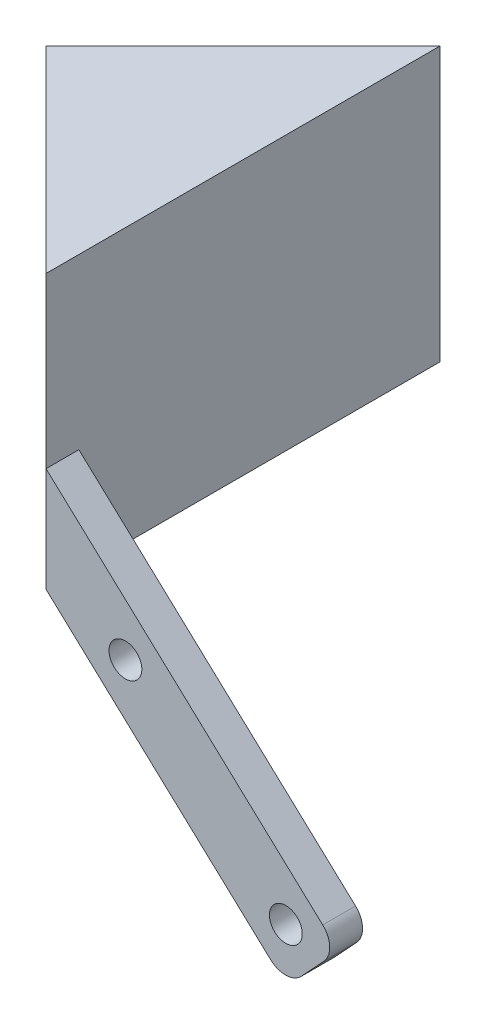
SolidWorks part; units mm, degrees
ref_plane "Plan de face" through (0, 0, 0) normal (0, 0, 1) x (1, 0, 0)
ref_plane "Plan de dessus" through (0, 0, 0) normal (0, 1, 0) x (1, 0, 0)
ref_plane "Plan de droite" through (0, 0, 0) normal (1, 0, 0) x (0, 0, -1)
sketch "Esquisse4" plane through (0, 0, 0) normal (0, 0, 1) x (1, 0, 0)
  line L0 (-17.4675, 6.1477) -> (4.5222, -14.2594)
  line L1 (9.2839, -9.1285) -> (-12.7059, 11.2787)
  line L2 (-12.7059, 11.2787) -> (-17.4675, 15.6977)
  line L3 (-17.4675, 15.6977) -> (-17.4675, 6.1477)
  line L4 (9.2839, -9.1285) -> (4.5222, -14.2594)
  circle A0 centre (4.4475, -9.4151) radius 1.5
  circle A1 centre (-10.2123, 4.1896) radius 1.5
  point P9 (6.903, -11.6939)
  dimension "D4" = 3
  dimension "D5" = 3
  dimension "D1" = 30
  dimension "D2" = 30
  dimension "D3" = 7
  dimension "D6" = 20
  dimension "D7" = 3.35
extrude "Boss.-Extru.3" add sketch "Esquisse4" along normal blind 3
sketch "Esquisse5" plane through (-17.4675, 0, 0) normal (-1, 0, 0) x (0, 0, 1)
  line L0 (3, 6.1477) -> (-33, 6.1477)
  line L1 (-33, 6.1477) -> (-33, 31.1477)
  line L2 (-33, 31.1477) -> (3, 31.1477)
  line L3 (3, 31.1477) -> (3, 6.1477)
  dimension "D1" = 25
  dimension "D2" = 36
extrude "Boss.-Extru.4" add sketch "Esquisse5" along normal blind 18
sketch "Esquisse6" plane through (0, 31.1477, 0) normal (0, 1, 0) x (1, 0, 0)
  line L0 (-17.4675, -3) -> (-35.4675, 15)
  line L1 (-35.4675, -3) -> (-35.4675, 33) construction
  line L2 (-35.4675, 15) -> (-17.4675, 33)
  line L3 (-17.4675, 33) -> (-17.4675, -3)
  line L4 (-17.4675, 33) -> (-35.4675, 15)
  line L5 (-17.4675, -3) -> (-35.4675, -3)
  line L6 (-35.4675, -3) -> (-35.4675, 33)
  line L7 (-35.4675, 33) -> (-17.4675, 33)
extrude "Enlèv. mat.-Extru.2" cut sketch "Esquisse6" along normal blind 1 and the other way blind 25 contours L0 M7 M6
sketch "Esquisse7" plane through (0, 31.1477, 0) normal (0, 1, 0) x (1, 0, 0)
  line L0 (-17.4675, 33) -> (-35.4675, 15)
  line L1 (-35.4675, 15) -> (-17.4675, -3) construction
  line L2 (-35.4675, 15) -> (-35.4675, 33)
  line L3 (-35.4675, 33) -> (-17.4675, 33)
extrude "Enlèv. mat.-Extru.3" cut sketch "Esquisse7" against normal blind 26
fillet "Congé3" radius 2 2 edges at (4.5222, -14.2594, 1.5) (9.2839, -9.1285, 1.5)
